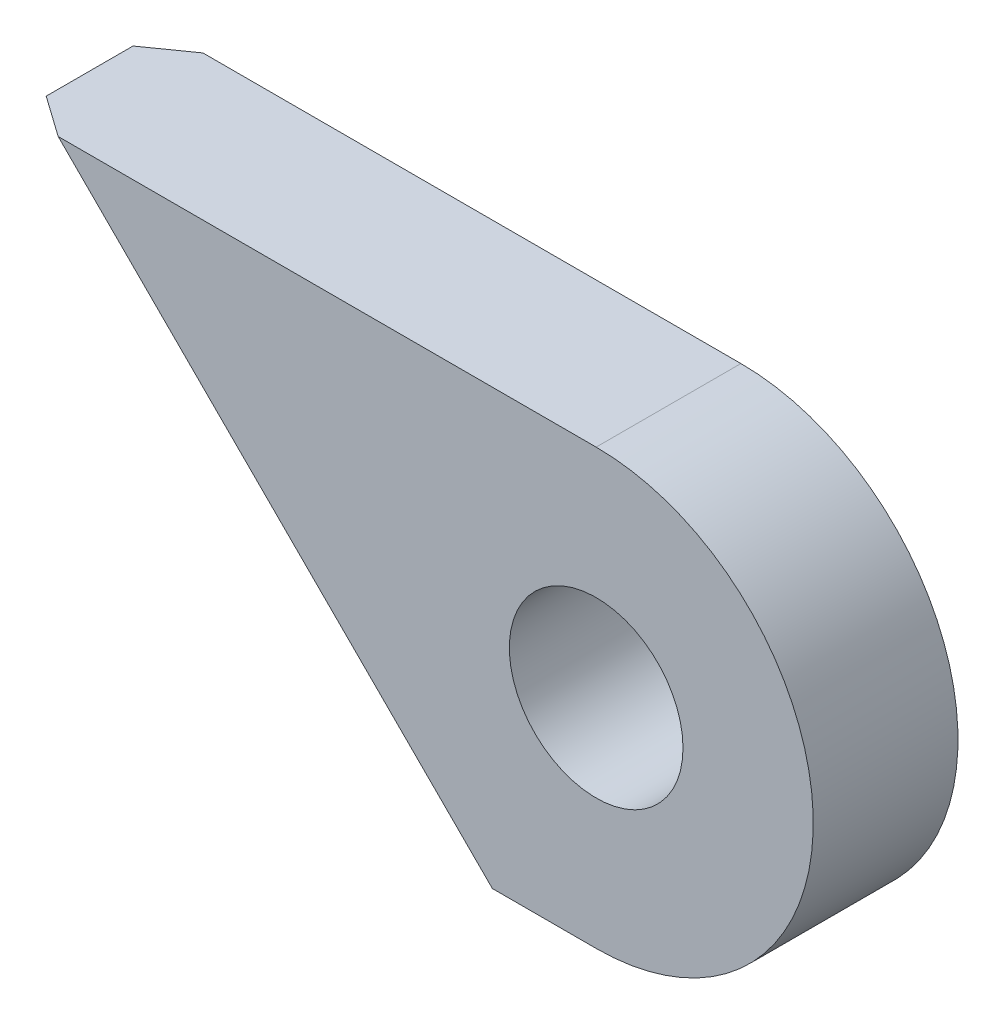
SolidWorks part; units mm, degrees
ref_plane "Face" through (0, 0, 0) normal (0, 0, 1) x (1, 0, 0)
ref_plane "Dessus" through (0, 0, 0) normal (0, 1, 0) x (1, 0, 0)
ref_plane "Droite" through (0, 0, 0) normal (1, 0, 0) x (0, 0, -1)
sketch "Esquisse1" plane through (0, 0, 0) normal (0, 0, 1) x (1, 0, 0)
  line L0 (0, 0) -> (30, -30)
  line L1 (0, 0) -> (40, 0)
  line L3 (30, -30) -> (40, -30)
  arc A0 (40, -30) -> (40, 0) centre (40, -15) ccw
  dimension "D2" = 40
extrude "Extrusion1" add sketch "Esquisse1" along normal blind 10
sketch "Esquisse2" plane through (0, 0, 10) normal (0, 0, 1) x (1, 0, 0)
  circle A0 centre (40, -15) radius 6
extrude "Enlèv. mat.-Extru.1" cut sketch "Esquisse2" against normal blind 10
chamfer "Chanfrein1" distance 2 angle 45 2 edges at (15, -15, 0) (15, -15, 10)
